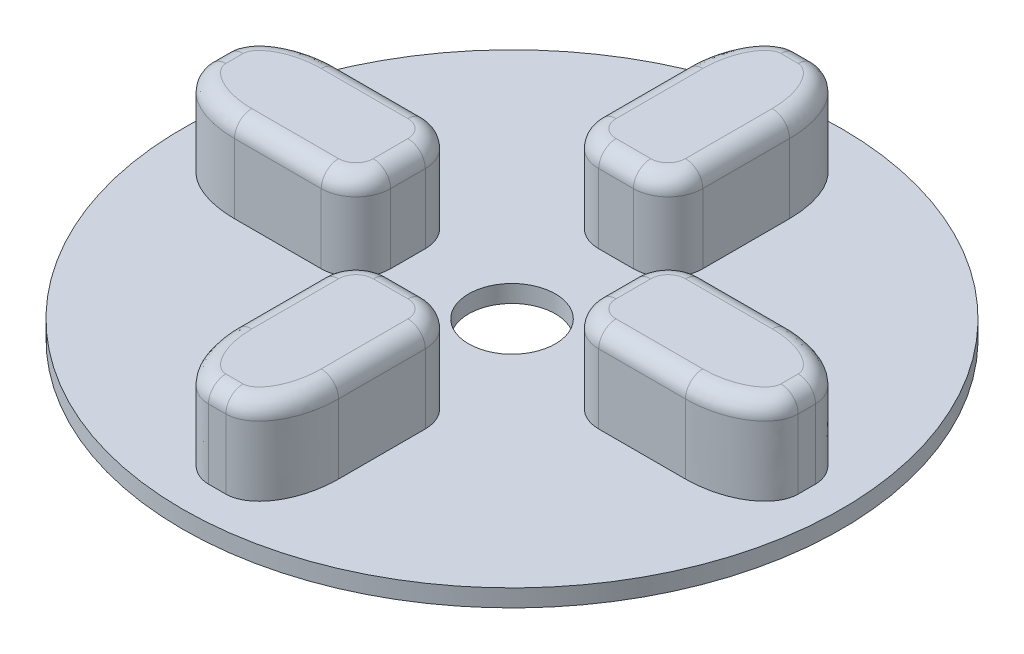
SolidWorks part; units mm, degrees
ref_plane "Front Plane" through (0, 0, 0) normal (0, 0, 1) x (1, 0, 0)
ref_plane "Top Plane" through (0, 0, 0) normal (0, 1, 0) x (1, 0, 0)
ref_plane "Right Plane" through (0, 0, 0) normal (1, 0, 0) x (0, 0, -1)
sketch "Sketch1" plane through (0, 0, 0) normal (0, 1, 0) x (1, 0, 0)
  circle A0 centre (0, 0) radius 19
  dimension "D1" = 38
extrude "Base" add sketch "Sketch1" along normal blind 1
sketch "Sketch2" plane through (0, 1, 0) normal (0, 1, 0) x (1, 0, 0)
  circle A0 centre (0, 0) radius 13 construction
  circle A1 centre (0, 13) radius 4.5
  circle A2 centre (13, 0) radius 4.5
  circle A3 centre (0, -13) radius 4.5
  circle A4 centre (-13, 0) radius 4.5
  point P14 (0, 0)
  dimension "D1" = 26
  dimension "D2" = 9
  dimension "D3" = 4
extrude "Buttons" [suppressed] add sketch "Sketch2" along normal blind 6
fillet "Fillet1" [suppressed] radius 1
hole_wizard "Ø5.0mm Dowel Hole1" positions "Sketch3" profile "Sketch4" hole size "Ø5.0" standard "ANSI Metric"
sketch "Sketch3" plane through (0, 1, 0) normal (0, 1, 0) x (1, 0, 0)
  point P0 (0, 0)
sketch "Sketch4" plane through (0, 1, 0) normal (1, 0, 0) x (0, 0, 1)
  line L0 (0, 0) -> (0, 1)
  line L1 (0, 1) -> (2.5, 1)
  line L2 (2.5, 1) -> (2.5, 0)
  line L5 (2.5, 0) -> (0, 0)
  line L11 (0, -6.35) -> (0, 107.95) construction
  dimension "Thru Hole Dia." = 5
  dimension "Thru Hole Depth" = 1
sketch "Sketch5" plane through (0, 1, 0) normal (0, 1, 0) x (1, 0, 0)
  line L0 (6, 3) -> (6, -3)
  line L1 (-3, 6) -> (3, 6)
  line L2 (-3, 6) -> (-3, 17)
  line L3 (-3, 17) -> (3, 17)
  line L4 (3, 6) -> (3, 17)
  line L5 (-3, 6) -> (3, 17) construction
  line L6 (-3, 17) -> (3, 6) construction
  line L7 (6, 3) -> (17, 3)
  line L8 (17, 3) -> (17, -3)
  line L9 (6, -3) -> (17, -3)
  line L10 (6, 3) -> (17, -3) construction
  line L11 (17, 3) -> (6, -3) construction
  line L12 (3, -6) -> (-3, -6)
  line L13 (3, -6) -> (3, -17)
  line L14 (3, -17) -> (-3, -17)
  line L15 (-3, -6) -> (-3, -17)
  line L16 (3, -6) -> (-3, -17) construction
  line L17 (3, -17) -> (-3, -6) construction
  line L18 (-6, -3) -> (-6, 3)
  line L19 (-6, -3) -> (-17, -3)
  line L20 (-17, -3) -> (-17, 3)
  line L21 (-6, 3) -> (-17, 3)
  line L22 (-6, -3) -> (-17, 3) construction
  line L23 (-17, -3) -> (-6, 3) construction
  circle A0 centre (0, 0) radius 11.5 construction
  point P3 (0, 11.5)
  point P8 (0, 0)
  point P11 (11.5, 0)
  point P16 (0, -11.5)
  point P21 (-11.5, 0)
  point P26 (0, 0)
  dimension "D1" = 23
  dimension "D2" = 6
  dimension "D3" = 11
  dimension "D4" = 4
extrude "DPad" add sketch "Sketch5" along normal blind 5
fillet "Fillet2" radius 2 8 edges at (-6, 3.5, -3) (-6, 3.5, 3) (-3, 3.5, 6) (3, 3.5, 6) (6, 3.5, 3) (6, 3.5, -3) (3, 3.5, -6) (-3, 3.5, -6)
fillet "Fillet3" radius 2.5 8 edges at (-17, 3.5, -3) (-17, 3.5, 3) (3, 3.5, 17) (-3, 3.5, 17) (17, 3.5, 3) (17, 3.5, -3) (-3, 3.5, -17) (3, 3.5, -17)
fillet "Fillet4" radius 1 32 edges at (-6.5858, 6, -2.4142) (-6, 6, 0) (-6.5858, 6, 2.4142) (-2.4142, 6, 6.5858) (0, 6, 6) (2.4142, 6, 6.5858) (6.5858, 6, 2.4142) (6, 6, 0) (6.5858, 6, -2.4142) (2.4142, 6, -6.5858) (0, 6, -6) (-2.4142, 6, -6.5858)
